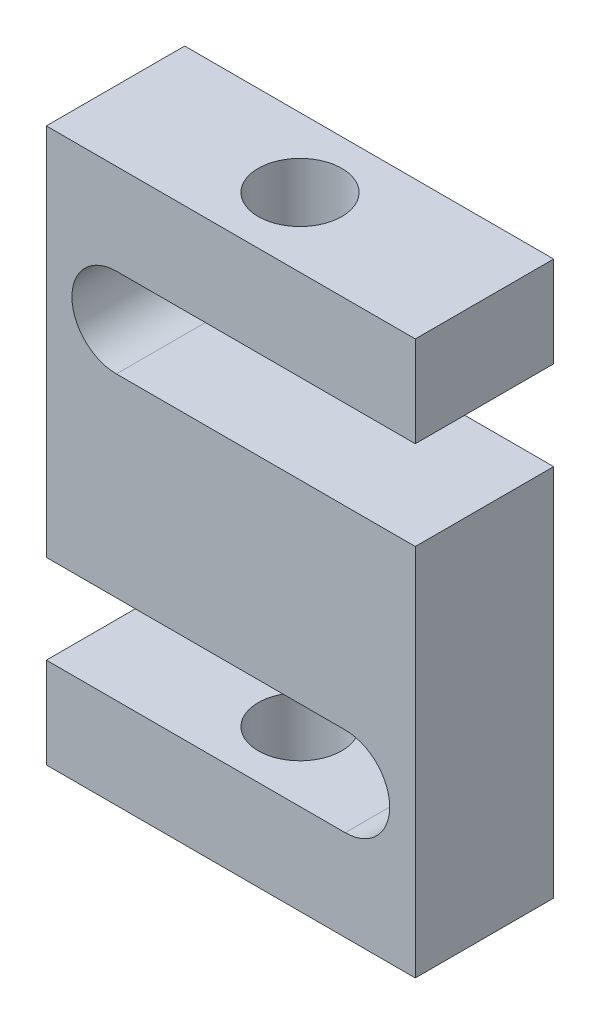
SolidWorks part; units mm, degrees
ref_plane "Front Plane" through (0, 0, 0) normal (0, 0, 1) x (1, 0, 0)
ref_plane "Top Plane" through (0, 0, 0) normal (0, 1, 0) x (1, 0, 0)
ref_plane "Right Plane" through (0, 0, 0) normal (1, 0, 0) x (0, 0, -1)
sketch "Sketch1" plane through (0, 0, 0) normal (0, 0, 1) x (1, 0, 0)
  line L0 (-25.4, -38.1) -> (25.4, -38.1)
  line L1 (25.4, -38.1) -> (25.4, 13.35)
  line L2 (25.4, 38.1) -> (-25.4, 38.1)
  line L3 (-25.4, 38.1) -> (-25.4, -13.35)
  line L4 (-25.4, -13.35) -> (15.748, -13.35)
  line L5 (-25.4, -25.6) -> (15.748, -25.6)
  line L6 (-69.5262, 0) -> (58.1333, 0) construction
  line L7 (15.748, -13.35) -> (15.748, -25.6) construction
  line L8 (-25.4, -25.6) -> (-25.4, -38.1)
  line L9 (-15.748, 25.6) -> (25.4, 25.6)
  line L10 (-15.748, 13.35) -> (25.4, 13.35)
  line L11 (25.4, 25.6) -> (25.4, 38.1)
  line L12 (-15.748, 25.6) -> (-15.748, 13.35) construction
  arc A0 (15.748, -25.6) -> (15.748, -13.35) centre (15.748, -19.475) ccw
  arc A1 (-15.748, 25.6) -> (-15.748, 13.35) centre (-15.748, 19.475) ccw
  dimension "D6" = 9.652
  dimension "D1" = 50.8
  dimension "D2" = 76.2
  dimension "D3" = 38.1
  dimension "D4" = 12.25
  dimension "D5" = 12.5
  dimension "D7" = 25.4
extrude "Extrude1" add sketch "Sketch1" along normal mid plane 19.05
hole_wizard "1/2-20 Tapped Hole1" positions "3DSketch2" profile "Sketch9" tap size "1/2-20" standard "Ansi Inch"
sketch3d "3DSketch2"
  point P0 (0, 38.1, 0)
sketch "Sketch9" plane through (0, 38.1, 0) normal (1, 0, 0) x (0, 0, 1)
  line L0 (0, 0) -> (0, 51.45)
  line L1 (0, 51.45) -> (5.7544, 51.45)
  line L2 (5.7544, 51.45) -> (5.7544, 0)
  line L5 (5.7544, 0) -> (0, 0)
  line L11 (0, -6.35) -> (0, 107.95) construction
  dimension "Thru Tap Drill Dia." = 11.5087
  dimension "Thru Tap Drill Depth" = 51.45
mirror "Mirror1" about plane through (0, 0, 0) normal (0, 1, 0) of "1/2-20 Tapped Hole1"
